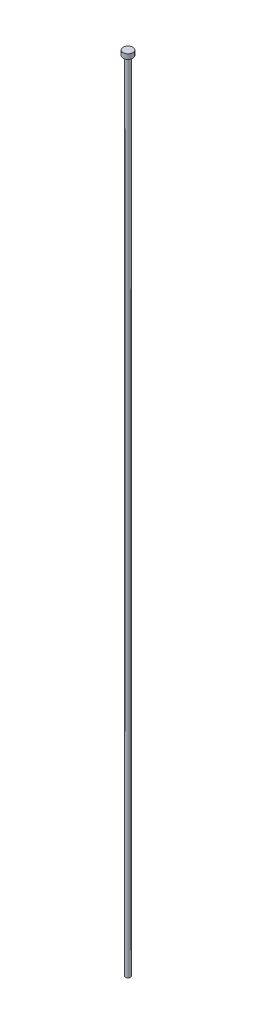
SolidWorks part; units mm, degrees
ref_plane "Front Plane" through (0, 0, 0) normal (0, 0, 1) x (1, 0, 0)
ref_plane "Top Plane" through (0, 0, 0) normal (0, 1, 0) x (1, 0, 0)
ref_plane "Right Plane" through (0, 0, 0) normal (1, 0, 0) x (0, 0, -1)
sketch "PinDia" plane through (0, 0, 0) normal (0, 1, 0) x (1, 0, 0)
  circle A0 centre (0, 0) radius 1.5
  dimension "D1" = 3
extrude "Length" add sketch "PinDia" against normal blind 500
sketch "HeadDia" plane through (0, 0, 0) normal (0, 1, 0) x (1, 0, 0)
  circle A0 centre (0, 0) radius 3
  dimension "D1" = 6
extrude "HeadThickness" add sketch "HeadDia" against normal blind 3
fillet "Fillet1" radius 0.3 1 edges at (0, -3, 1.5)
